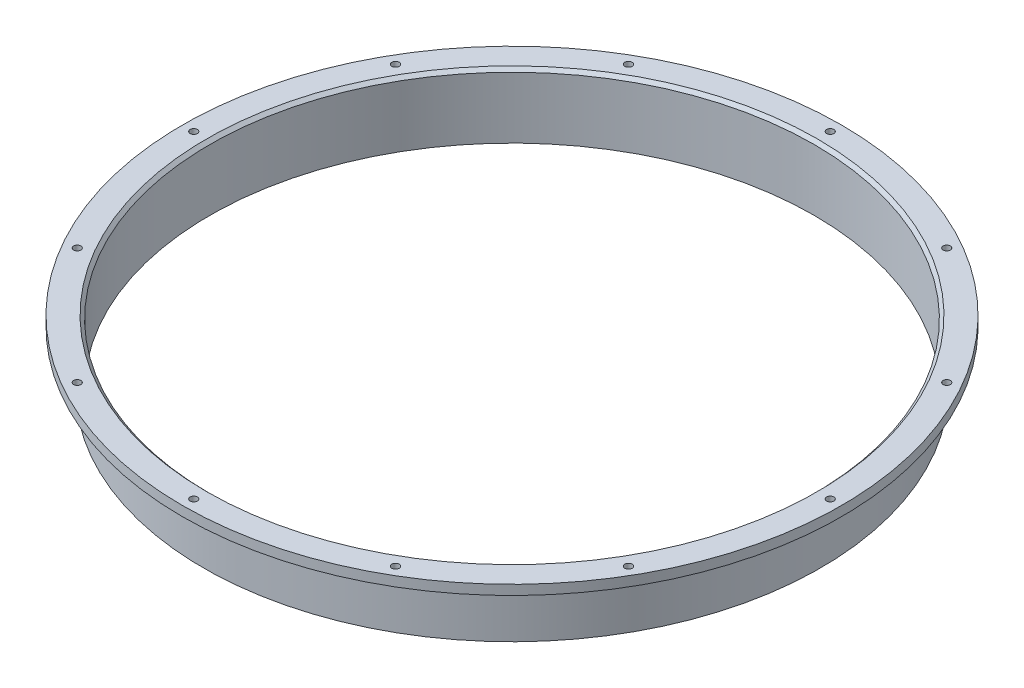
SolidWorks part; units mm, degrees
ref_plane "Front Plane" through (0, 0, 0) normal (0, 0, 1) x (1, 0, 0)
ref_plane "Top Plane" through (0, 0, 0) normal (0, 1, 0) x (1, 0, 0)
ref_plane "Right Plane" through (0, 0, 0) normal (1, 0, 0) x (0, 0, -1)
sketch "Sketch1" plane through (0, 0, 0) normal (0, 1, 0) x (1, 0, 0)
  circle A0 centre (0, 0) radius 323.85
  dimension "D1" = 647.7
extrude "Extrude1" add sketch "Sketch1" against normal blind 63.5
sketch "Sketch2" plane through (0, 0, 0) normal (0, 1, 0) x (-1, 0, 0)
  circle A0 centre (0, 0) radius 296.9895
  dimension "D1" = 593.979
extrude "Cut-Extrude1" cut sketch "Sketch2" against normal through all
sketch "Sketch3" plane through (0, -63.5, 0) normal (0, -1, 0) x (1, 0, 0)
  circle A0 centre (0, 0) radius 303.2125
  dimension "D1" = 606.425
extrude "Cut-Extrude2" cut sketch "Sketch3" against normal blind 53.975 flip side to cut
sketch "Sketch4" plane through (0, 0, 0) normal (0, 1, 0) x (-1, 0, 0)
  circle A0 centre (0, -312.7248) radius 3.5687
  dimension "D1" = 7.1374
  dimension "D2" = 312.7248
extrude "Cut-Extrude3" cut sketch "Sketch4" against normal through all
pattern_circular "CirPattern1" count 12 over 360 about axis through (0, 0, 0) along (0, 1, 0) of "Cut-Extrude3"
chamfer "Chamfer1" distance 3.175 angle 45 1 edges at (0, 0, 296.9895)
